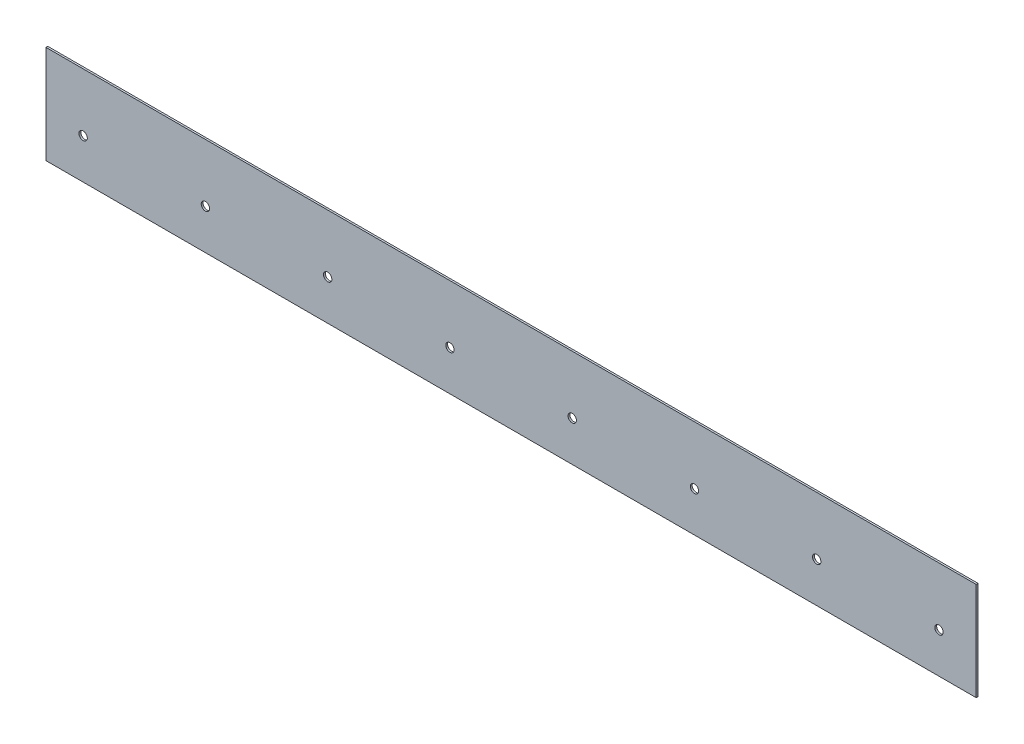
SolidWorks part; units mm, degrees
ref_plane "Front" through (0, 0, 0) normal (0, 0, 1) x (1, 0, 0)
ref_plane "Top" through (0, 0, 0) normal (0, 1, 0) x (1, 0, 0)
ref_plane "Right" through (0, 0, 0) normal (1, 0, 0) x (0, 0, -1)
sketch "Sketch1" plane through (0, 0, 0) normal (0, 0, 1) x (1, 0, 0)
  line L1 (0, 0) -> (5010.6335, 0)
  line L2 (0, 0) -> (0, 528.5351)
  line L3 (0, 528.5351) -> (5010.6335, 528.5351)
  line L4 (5010.6335, 0) -> (5010.6335, 528.5351)
extrude "Extrude1" add sketch "Sketch1" along normal blind 10
hole_wizard "Ø45.0 (45) Diameter Hole1" positions "Sketch3" profile "Sketch2" hole size "Ø45.0" standard "DIN"
sketch "Sketch3" plane through (0, 0, 10) normal (0, 0, 1) x (1, 0, 0)
  line L0 (0, 216.2998) -> (200, 216.2998)
  line L1 (0, 528.5351) -> (0, 0) construction
  line L2 (5010.6335, 0) -> (5010.6335, 528.5351) construction
  line L4 (4810.6335, 216.2998) -> (5010.6335, 216.2998)
  line L5 (200, 216.2998) -> (4810.6335, 216.2998)
  point P0 (200, 216.2998)
  dimension "D1" = 200
  dimension "D2" = 200
  dimension "D3" = 4610.6335
sketch "Sketch2" plane through (200, 216.2998, 10) normal (1, 0, 0) x (0, -1, 0)
  line L0 (0, 0) -> (0, 10)
  line L1 (0, 10) -> (22.5, 10)
  line L2 (22.5, 10) -> (22.5, 0)
  line L5 (22.5, 0) -> (0, 0)
  line L11 (0, -6.35) -> (0, 107.95) construction
  dimension "Thru Hole Dia." = 45
  dimension "Thru Hole Depth" = 10
pattern_linear "LPattern1" count 8 spacing 658.6619 along (1, 0, 0) of "Ø45.0 (45) Diameter Hole1"
equation "\"x\"=\"D3@Sketch3\" /700"
equation "\"D3@LPattern1\"=\"D3@Sketch3\" /(\"D1@LPattern1\"-1)"
equation "\"D1@LPattern1\" = Iif(\"x\"-int(\"x\")<>0,int(\"x\")+1,\"x\")+1"
